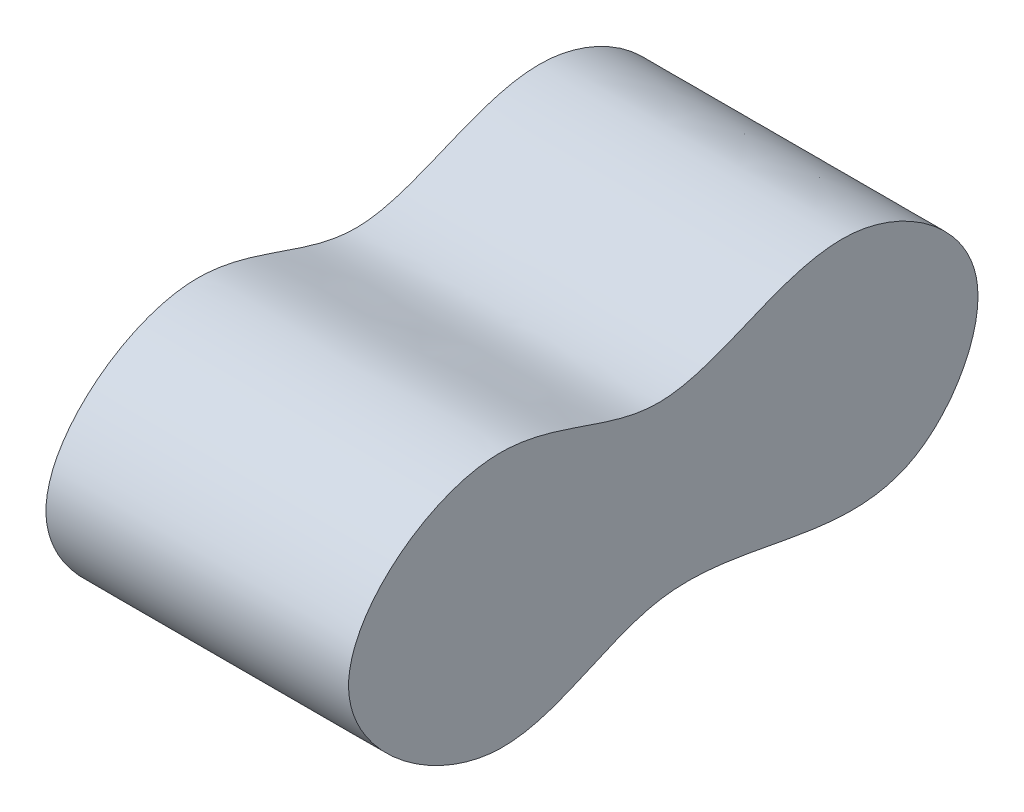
SolidWorks part; units mm, degrees
ref_plane "Front Plane" through (0, 0, 0) normal (0, 0, 1) x (1, 0, 0)
ref_plane "Top Plane" through (0, 0, 0) normal (0, 1, 0) x (1, 0, 0)
ref_plane "Right Plane" through (0, 0, 0) normal (1, 0, 0) x (0, 0, -1)
sketch "Sketch1" plane through (0, 0, 0) normal (1, 0, 0) x (0, 0, -1)
  spline S0 degree 3 poles (2.7668, 20.3128) (-55.4421, 63.9858) (-128.4114, 5.5654) (-52.9597, -53.9002) (6.0729, -2.6612) (78.8496, -46.4327) (118.8785, 23.7539) (57.6851, 69.0984) (2.7668, 20.3128) (-55.4421, 63.9858) (-128.4114, 5.5654) knots -0.36138 -0.251212 -0.116928 0 0.127336 0.261095 0.375018 0.549387 0.63862 0.748788 0.883072 1 1.127336 1.261095 1.375018 only from (-56.0392, 47.6773) to (-56.0392, 47.6773)
extrude "Boss-Extrude1" add sketch "Sketch1" along normal mid plane 100
sketch "Sketch2" plane through (0, 0, 0) normal (1, 0, 0) x (0, 0, -1)
  spline S0 degree 3 poles (-128.4114, 5.5654) (-55.4421, 63.9858) (2.7668, 20.3128) (57.6851, 69.0984) (118.8785, 23.7539) (78.8496, -46.4327) (6.0729, -2.6612) (-52.9597, -53.9002) (-128.4114, 5.5654) (-55.4421, 63.9858) (2.7668, 20.3128) knots -0.375018 -0.261095 -0.127336 0 0.116928 0.251212 0.36138 0.450613 0.624982 0.738905 0.872664 1 1.116928 1.251212 1.36138 only from (-56.0392, 47.6773) to (-56.0392, 47.6773)
  spline S1 degree 3 poles (-128.4114, 5.5654) (-55.4421, 63.9858) (2.7668, 20.3128) (57.6851, 69.0984) (118.8785, 23.7539) (78.8496, -46.4327) (6.0729, -2.6612) (-52.9597, -53.9002) (-128.4114, 5.5654) (-55.4421, 63.9858) (2.7668, 20.3128) knots -0.375018 -0.261095 -0.127336 0 0.116928 0.251212 0.36138 0.450613 0.624982 0.738905 0.872664 1 1.116928 1.251212 1.36138 only from (-56.0392, 47.6773) to (-56.0392, 47.6773)
